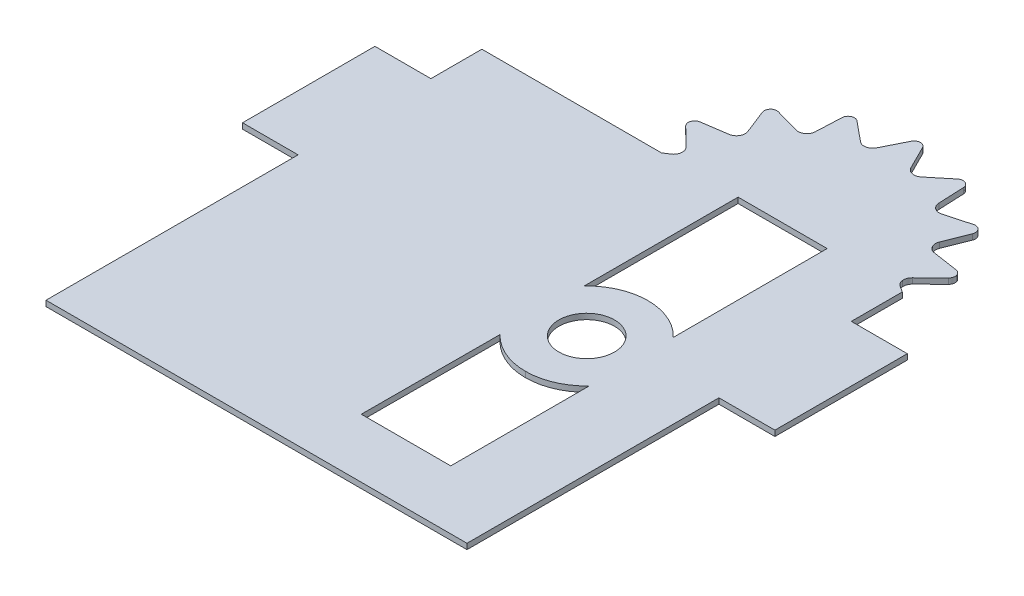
SolidWorks part; units mm, degrees
ref_plane "Front Plane" through (0, 0, 0) normal (0, 0, 1) x (1, 0, 0)
ref_plane "Top Plane" through (0, 0, 0) normal (0, 1, 0) x (1, 0, 0)
ref_plane "Right Plane" through (0, 0, 0) normal (1, 0, 0) x (0, 0, -1)
imported_body "Stock-Page 4 and 5-1"
sketch "Sketch1" plane through (0, 2, 0) normal (0, 1, 0) x (1, 0, 0)
  line L5 (36.5597, -43.2847) -> (-43.0896, -43.2847)
  line L6 (36.5597, -43.2847) -> (36.5597, -49.1283)
  line L7 (36.5597, -49.1283) -> (-43.0896, -49.1283)
  line L8 (-43.0896, -43.2847) -> (-43.0896, -49.1283)
extrude "Cut-Extrude2" cut sketch "Sketch1" against normal blind 10
